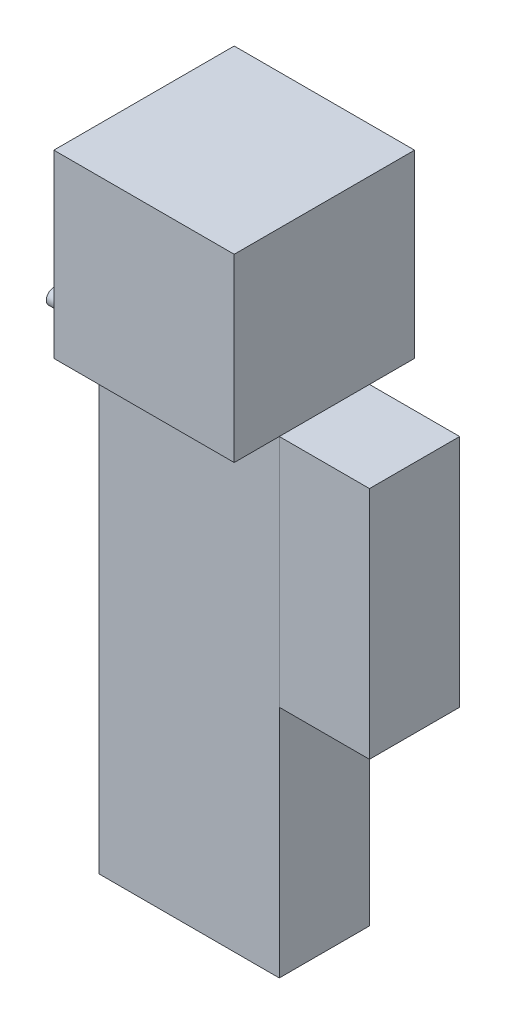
SolidWorks part; units mm, degrees
other "Arm"
other "Body"
other "Body+Leg"
other "Head"
ref_plane "Front Plane" through (0, 0, 0) normal (0, 0, 1) x (1, 0, 0)
ref_plane "Top Plane" through (0, 0, 0) normal (0, 1, 0) x (1, 0, 0)
ref_plane "Right Plane" through (0, 0, 0) normal (1, 0, 0) x (0, 0, -1)
sketch "Sketch1" plane through (0, 0, 0) normal (0, 1, 0) x (1, 0, 0)
  line L1 (-19.05, -9.525) -> (19.05, -9.525)
  line L2 (-19.05, -9.525) -> (-19.05, 9.525)
  line L3 (-19.05, 9.525) -> (19.05, 9.525)
  line L4 (19.05, -9.525) -> (19.05, 9.525)
  line L5 (-19.05, -9.525) -> (19.05, 9.525) construction
  line L6 (-19.05, 9.525) -> (19.05, -9.525) construction
  point P0 (0, 0)
  dimension "D1" = 19.05
  dimension "D2" = 38.1
extrude "Boss-Extrude1" add sketch "Sketch1" along normal blind 49.53
sketch "Sketch2" plane through (0, 49.53, 0) normal (0, 1, 0) x (1, 0, 0)
  line L1 (-19.05, -9.525) -> (19.05, -9.525)
  line L2 (-19.05, -9.525) -> (-19.05, 9.525)
  line L3 (-19.05, 9.525) -> (19.05, 9.525)
  line L4 (19.05, -9.525) -> (19.05, 9.525)
  line L5 (-19.05, -9.525) -> (19.05, 9.525) construction
  line L6 (-19.05, 9.525) -> (19.05, -9.525) construction
  point P0 (0, 0)
extrude "Boss-Extrude2" add sketch "Sketch2" along normal blind 49.53
sketch "Sketch3" plane through (0, 99.06, 0) normal (0, 1, 0) x (1, 0, 0)
  line L1 (-19.05, -19.05) -> (19.05, -19.05)
  line L2 (-19.05, -19.05) -> (-19.05, 19.05)
  line L3 (-19.05, 19.05) -> (19.05, 19.05)
  line L4 (19.05, -19.05) -> (19.05, 19.05)
  line L5 (-19.05, -19.05) -> (19.05, 19.05) construction
  line L6 (-19.05, 19.05) -> (19.05, -19.05) construction
  point P0 (0, 0)
extrude "Boss-Extrude3" add sketch "Sketch3" along normal blind 38.1
sketch "Sketch4" plane through (19.05, 0, 0) normal (1, 0, 0) x (0, 0, -1)
  line L0 (0, 137.16) -> (0, 0) construction
  line L1 (-19.05, 137.16) -> (19.05, 137.16) construction
  line L2 (-9.525, 99.06) -> (9.525, 99.06) construction
  line L3 (-9.525, 49.53) -> (9.525, 49.53) construction
  line L4 (-9.525, 99.06) -> (-9.525, 0) construction
  line L5 (9.525, 99.06) -> (9.525, 0) construction
  circle A0 centre (0, 91.44) radius 1.5875
  dimension "D1" = 3.175
  dimension "D2" = 7.62
extrude "Boss-Extrude4" add sketch "Sketch4" along normal blind 19.05
mirror "Mirror1" about plane through (0, 0, 0) normal (1, 0, 0) of "Boss-Extrude4"
sketch "Sketch5" plane through (19.05, 0, 0) normal (1, 0, 0) x (0, 0, -1)
  line L0 (9.525, 99.06) -> (9.525, 0) construction
  line L1 (-9.525, 99.06) -> (9.525, 99.06)
  line L2 (-9.525, 99.06) -> (-9.525, 49.53)
  line L3 (-9.525, 49.53) -> (9.525, 49.53)
  line L4 (9.525, 99.06) -> (9.525, 49.53)
  dimension "D1" = 49.53
extrude "Boss-Extrude5" add sketch "Sketch5" along normal blind 19.05 contours L3 L1 M13 M7 M5
split "Split1" bodies to split 106 resulting bodies 107 108
split "Split2" bodies to split 108 107 resulting bodies 109 110 111
